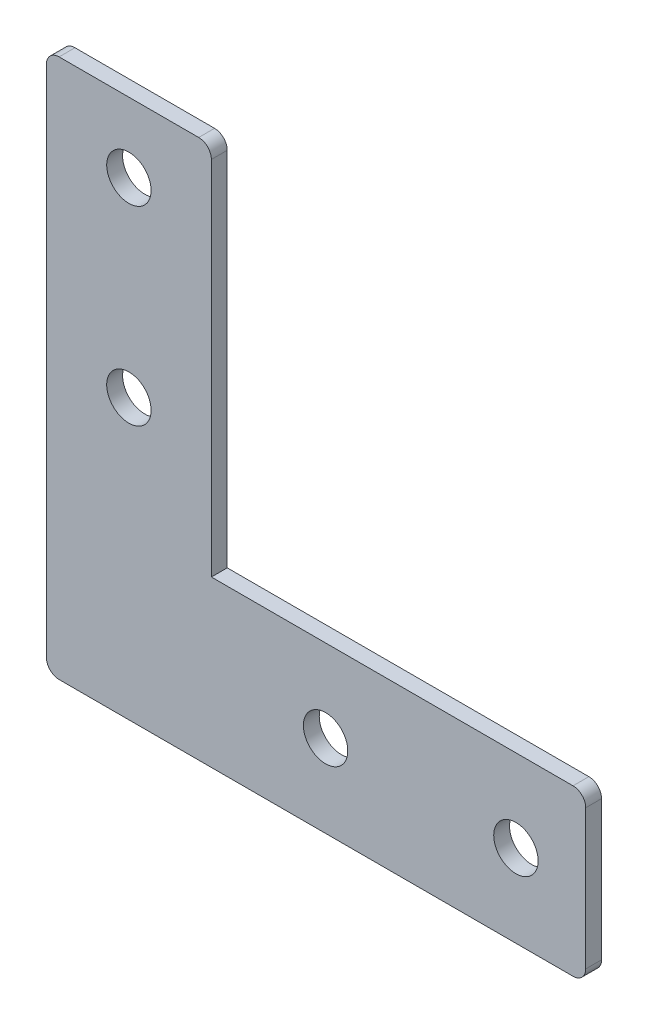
SolidWorks part; units mm, degrees
ref_plane "前视基准面" through (0, 0, 0) normal (0, 0, 1) x (1, 0, 0)
ref_plane "上视基准面" through (0, 0, 0) normal (0, 1, 0) x (1, 0, 0)
ref_plane "右视基准面" through (0, 0, 0) normal (1, 0, 0) x (0, 0, -1)
sketch "草图1" plane through (0, 0, 0) normal (0, 0, 1) x (1, 0, 0)
  line L0 (0, 0) -> (85, 0)
  line L1 (85, 0) -> (85, 26)
  line L2 (85, 26) -> (26, 26)
  line L3 (26, 26) -> (26, 85)
  line L4 (26, 85) -> (0, 85)
  line L5 (0, 85) -> (0, 0)
  line L6 (26, 26) -> (0, 0) construction
  circle A0 centre (13, 74) radius 3.5
  circle A1 centre (13, 44) radius 3.5
  circle A2 centre (44, 13) radius 3.5
  circle A3 centre (74, 13) radius 3.5
  dimension "D5" = 7
  dimension "D6" = 7
  dimension "D7" = 11
  dimension "D8" = 30
  dimension "D1" = 59
  dimension "D2" = 59
  dimension "D3" = 85
  dimension "D4" = 85
extrude "凸台-拉伸1" add sketch "草图1" along normal mid plane 2.5
fillet "圆角1" radius 2 5 edges at (85, 0, 0) (85, 26, 0) (0, 0, 0) (0, 85, 0) (26, 85, 0)
